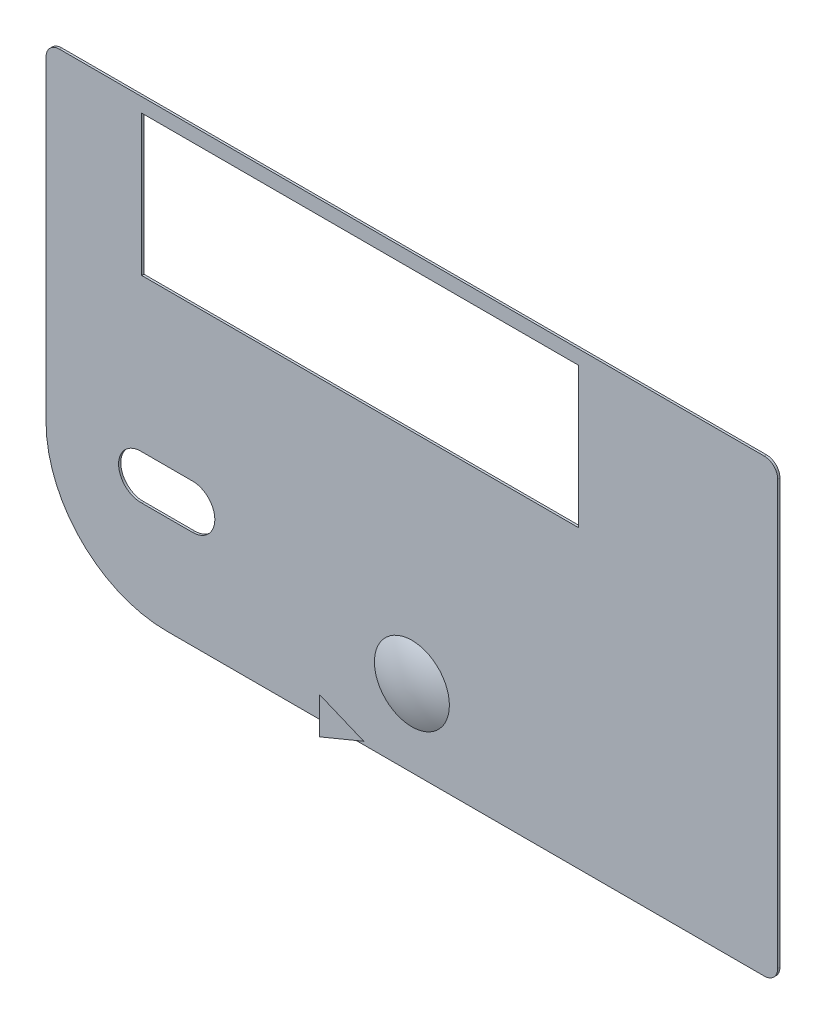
SolidWorks part; units mm, degrees
ref_plane "Vorne" through (0, 0, 0) normal (0, 0, 1) x (1, 0, 0)
ref_plane "Oben" through (0, 0, 0) normal (0, 1, 0) x (1, 0, 0)
ref_plane "Rechts" through (0, 0, 0) normal (1, 0, 0) x (0, 0, -1)
sketch "Skizze1" plane through (0, 0, 0) normal (0, 0, 1) x (1, 0, 0)
  line L1 (-47.625, 30.425) -> (47.625, 30.425)
  line L2 (-49.425, 28.625) -> (-49.425, -14.125)
  line L3 (-33.125, -30.425) -> (47.625, -30.425)
  line L4 (49.425, 28.625) -> (49.425, -28.625)
  arc A0 (-47.625, 30.425) -> (-49.425, 28.625) centre (-47.625, 28.625) ccw
  arc A1 (47.625, 30.425) -> (49.425, 28.625) centre (47.625, 28.625) cw
  arc A2 (47.625, -30.425) -> (49.425, -28.625) centre (47.625, -28.625) ccw
  arc A3 (-49.425, -14.125) -> (-33.125, -30.425) centre (-33.125, -14.125) ccw
  point P4 (0, 30.425)
  point P6 (49.425, 0)
  dimension "D1" = 1.8
  dimension "D2" = 16.3
  dimension "D3" = 98.85
  dimension "D4" = 60.85
extrude "Linear austragen1" add sketch "Skizze1" against normal blind 0.3
sketch "Skizze2" plane through (0, 0, 0) normal (0, 0, 1) x (1, 0, 0)
  line L1 (-36.625, -11.1248) -> (-29.625, -11.1248)
  line L3 (-36.4881, -17.1248) -> (-29.625, -17.1248)
  arc A0 (-29.625, -17.1248) -> (-29.625, -11.1248) centre (-29.625, -14.1248) ccw
  arc A1 (-36.625, -11.1248) -> (-36.4881, -17.1248) centre (-36.625, -14.1263) ccw
  point P0 (-33.125, -14.125)
  point P6 (-33.125, -11.1248)
  dimension "D2" = 7
  dimension "D1" = 6
extrude "Linear austragen2" cut sketch "Skizze2" against normal blind 10
sketch "Skizze4" plane through (0, 0, -0.3) normal (0, 0, -1) x (-1, 0, 0)
  line L1 (-22.5, 9.5) -> (-22.5, 28.5)
  line L3 (36.5, 9.5) -> (-22.5, 9.5)
  line L5 (-22.5, 28.5) -> (36.5, 28.5)
  line L7 (36.5, 28.5) -> (36.5, 9.5)
  dimension "D1" = 9.5
  dimension "D2" = 19
  dimension "D3" = 59
  dimension "D4" = 22.5
extrude "Linear austragen3" cut sketch "Skizze4" against normal blind 10
sketch "Skizze5" plane through (0, 0, 0) normal (1, 0, 0) x (0, 0, -1)
  line L0 (0.3, -15) -> (0.3, -20)
  line L1 (0.3, 28.625) -> (0.3, -14.125) construction
  line L2 (0.3, -17.1248) -> (0.3, -11.1248) construction
  line L3 (0.3, -20) -> (-0.7913, -20)
  arc A0 (-0.7913, -20) -> (0.3, -15) centre (11.2087, -20) cw
  dimension "D3" = 12
  dimension "D1" = 20
  dimension "D2" = 5
revolve "Rotation1" add sketch "Skizze5" angle 360 about L3
other "Einbuchtung1" parameters "D1"=0.3, "D2"=0
ref_plane "Ebene1" through (0, 0, 10) normal (0, 0, 1) x (1, 0, 0)
sketch "Skizze8" plane through (0, 0, 10) normal (0, 0, 1) x (1, 0, 0)
  line L0 (3.5, -20) -> (-2.5, -17.5147)
  line L1 (-2.5, -17.5147) -> (-2.5, -22.4853)
  line L2 (-2.5, -22.4853) -> (3.5, -20)
  line L3 (3.5, -20) -> (-2.5, -20) construction
  dimension "D1" = 6
  dimension "D2" = 20
  dimension "D3" = 45
  dimension "D4" = 3.5
surface "Oberfläche-Ebene3" sketch "Skizze8"
